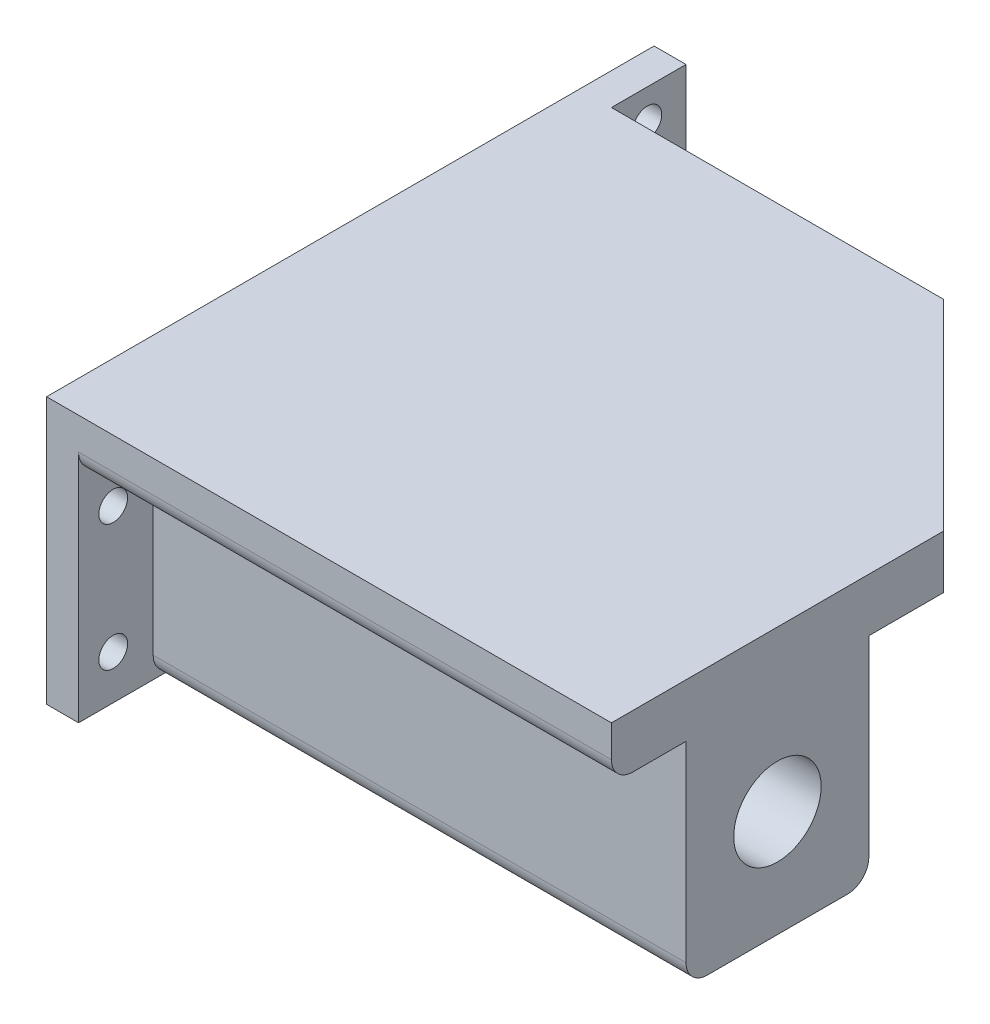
SolidWorks part; units mm, degrees
ref_plane "Front Plane" through (0, 0, 0) normal (0, 0, 1) x (1, 0, 0)
ref_plane "Top Plane" through (0, 0, 0) normal (0, 1, 0) x (1, 0, 0)
ref_plane "Right Plane" through (0, 0, 0) normal (1, 0, 0) x (0, 0, -1)
sketch "Sketch1" plane through (0, 0, 0) normal (0, 1, 0) x (1, 0, 0)
  line L0 (5.5296, -25.619) -> (24.381, -25.619)
  line L1 (-25.619, -25.619) -> (5.5296, -25.619)
  line L2 (-25.619, -25.619) -> (-25.619, 24.381)
  line L3 (-25.619, 24.381) -> (5.531, 24.381)
  line L4 (24.381, -6.7676) -> (24.381, 5.531)
  line L5 (-25.619, -25.619) -> (14.956, 14.956) construction
  line L6 (-25.619, 24.381) -> (15.9599, -15.1887) construction
  line L7 (24.381, -25.619) -> (24.381, -6.7676)
  line L8 (5.531, 24.381) -> (24.381, 5.531)
  circle A0 centre (3.381, 6.381) radius 8 construction
  circle A1 centre (-13.119, -9.119) radius 8 construction
  point P0 (0, 0)
extrude "Boss-Extrude1" add sketch "Sketch1" along normal blind 5
sketch "Sketch2" plane through (0, 0, 0) normal (0, -1, 0) x (1, 0, 0)
  line L0 (24.381, 10.044) -> (-25.619, 10.044) construction
  line L1 (24.381, 25.619) -> (24.381, -5.531) construction
  line L2 (-25.619, -24.381) -> (-25.619, 25.619) construction
  line L4 (-25.619, 18.619) -> (24.381, 18.619)
  line L5 (-25.619, 18.619) -> (-25.619, 1.469)
  line L6 (-25.619, 1.469) -> (24.381, 1.469)
  line L7 (24.381, 18.619) -> (24.381, 1.469)
  line L8 (-25.619, 18.619) -> (24.381, 1.469) construction
  line L9 (-25.619, 1.469) -> (24.381, 18.619) construction
  line L10 (-25.619, 25.619) -> (24.381, 25.619) construction
  point P6 (-0.619, 10.044)
  dimension "D1" = 7
extrude "Boss-Extrude2" add sketch "Sketch2" along normal blind 20
sketch "Sketch3" plane through (24.381, 0, 0) normal (1, 0, 0) x (0, 0, -1)
  line L0 (-10.044, -20) -> (-10.044, 5.2938) construction
  line L1 (-1.469, -20) -> (-18.619, -20) construction
  line L2 (-18.619, -10) -> (-1.469, -10) construction
  line L3 (-18.619, -20) -> (-18.619, 0) construction
  line L4 (-1.469, -20) -> (-1.469, 0) construction
  circle A0 centre (-10.044, -10) radius 4.1
  point P13 (-10.044, -10)
extrude "Cut-Extrude1" cut sketch "Sketch3" against normal blind 30
fillet "Fillet1" radius 2 4 edges at (-10.044, 0, -24.381) (-0.619, 0, 25.619) (-0.619, -20, 1.469) (-0.619, -20, 18.619)
sketch "Sketch8" plane through (-25.619, 0, 0) normal (-1, 0, 0) x (0, 0, 1)
  line L0 (32.7919, 5) -> (-48.7637, 5) construction
  line L1 (-31.381, 5) -> (25.619, 5)
  line L2 (-31.381, 5) -> (-31.381, -20)
  line L3 (25.619, 5) -> (25.619, -20)
  line L4 (-31.381, -20) -> (25.619, -20)
  line L5 (16.619, -20) -> (3.469, -20) construction
  dimension "D1" = 7
extrude "Boss-Extrude5" add sketch "Sketch8" along normal blind 3
sketch "Sketch9" plane through (-25.619, 0, 0) normal (1, 0, 0) x (0, 0, -1)
  circle A0 centre (27.7527, 2.0917) radius 1.35
  circle A1 centre (27.7527, -15.858) radius 1.35
  circle A2 centre (-22.3682, -15.858) radius 1.35
  circle A3 centre (-22.3682, -3.996) radius 1.35
extrude "Cut-Extrude2" cut sketch "Sketch9" against normal through all both and the other way through all
equation "\"screws\"= 2.7mm"
equation "\"D1@Sketch9\"=\"screws\""
equation "\"D2@Sketch9\"=\"screws\""
equation "\"D3@Sketch9\"=\"screws\""
equation "\"D4@Sketch9\"=\"screws\""
equation "\"barra\"= 8mm"
equation "\"D1@Sketch3\"=\"barra\"+0.2"
equation "\"a\"=12.5"
equation "\"b\"=18"
equation "\"c\"=29"
equation "\"d\"= 16.5"
equation "\"D6@Sketch1\"=\"c\""
equation "\"D5@Sketch1\"=\"b\""
equation "\"D8@Sketch1\"=\"d\""
equation "\"D7@Sketch1\"=\"a\""
